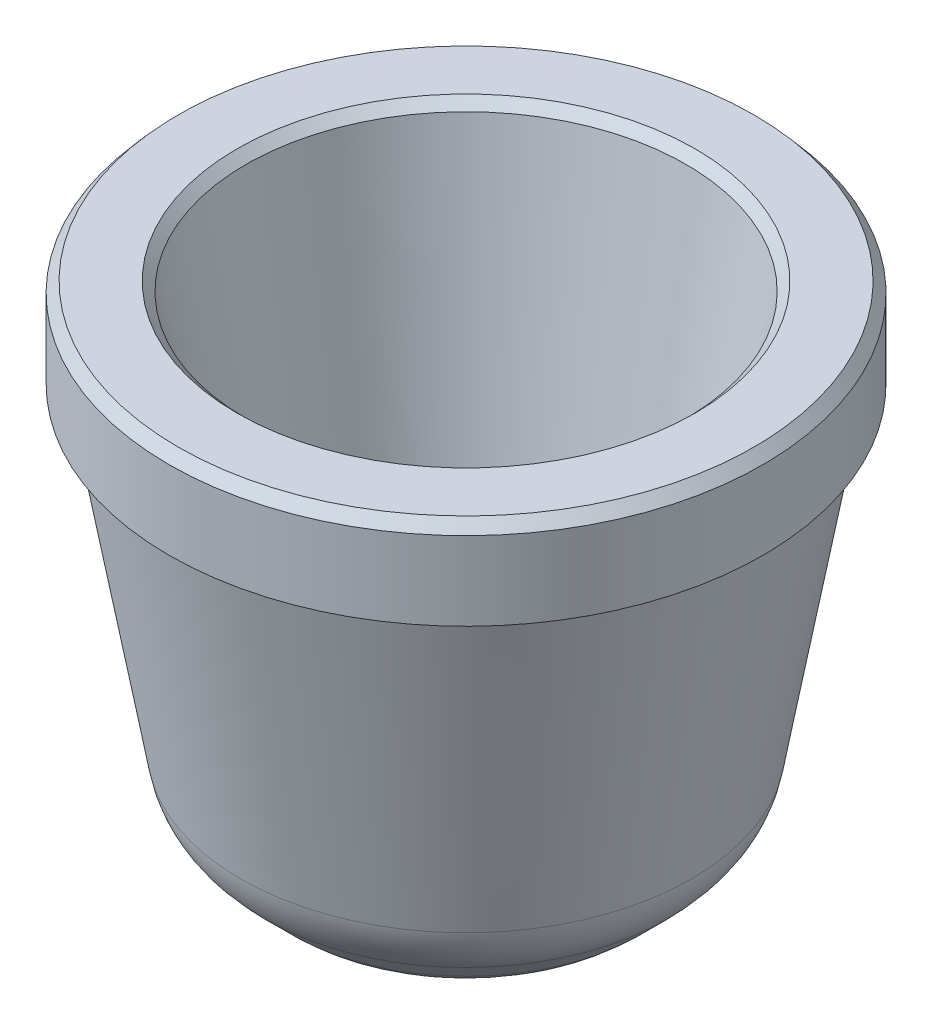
SolidWorks part; units mm, degrees
ref_plane "Plane1" through (0, 0, 0) normal (0, 0, 1) x (1, 0, 0)
ref_plane "Plane2" through (0, 0, 0) normal (0, 1, 0) x (1, 0, 0)
ref_plane "Plane3" through (0, 0, 0) normal (1, 0, 0) x (0, 0, -1)
sketch "Sketch1" plane through (0, 0, 0) normal (0, 0, 1) x (1, 0, 0)
  line L0 (0, 0) -> (5.08, 0)
  line L1 (5.08, 0) -> (3.775, -7.401)
  line L2 (3.775, -7.401) -> (2.54, -8.636)
  line L3 (2.54, -8.636) -> (0, -8.636)
  line L4 (0, -8.636) -> (0, 0)
  line L5 (0, 0) -> (0, -8.636) construction
  dimension "D1" = 45
  dimension "D2" = 5.08
  dimension "D3" = 10
  dimension "D4" = 8.636
  dimension "D5" = 2.54
revolve "Body" add sketch "Sketch1" angle 360 about L5
fillet "Fillet1" radius 1.524 2 edges at (0, -8.636, 2.54) (0, -7.401, 3.775)
shell "Shell1" thickness 1.27
sketch "Sketch2" plane through (0, 0, 0) normal (0, 1, 0) x (-1, 0, 0)
  circle A0 centre (0, 0) radius 5.08 construction
  circle A1 centre (0, 0) radius 5.08
  circle A2 centre (0, 0) radius 3.7904 construction
  circle A3 centre (0, 0) radius 3.7904
extrude "Rim" add sketch "Sketch2" against normal blind 1.524
chamfer "Chamfer1" distance 0.127 angle 45 2 edges at (0, 0, 3.7904) (0, 0, 5.08)
